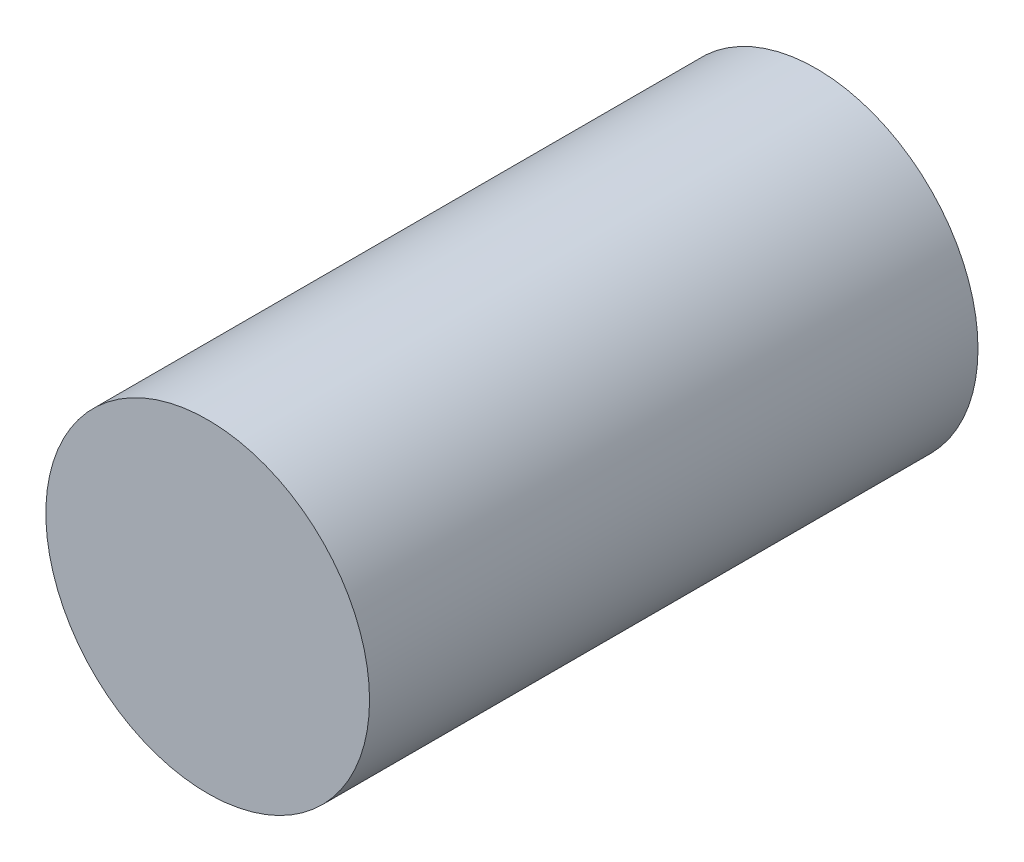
SolidWorks part; units mm, degrees
ref_plane "Front Plane" through (0, 0, 0) normal (0, 0, 1) x (1, 0, 0)
ref_plane "Top Plane" through (0, 0, 0) normal (0, 1, 0) x (1, 0, 0)
ref_plane "Right Plane" through (0, 0, 0) normal (1, 0, 0) x (0, 0, -1)
sketch "Sketch1" plane through (0, 0, 0) normal (0, 0, 1) x (1, 0, 0)
  circle A0 centre (0, 0) radius 3.325
extrude "Boss-Extrude1" add sketch "Sketch1" along normal blind 12.5
